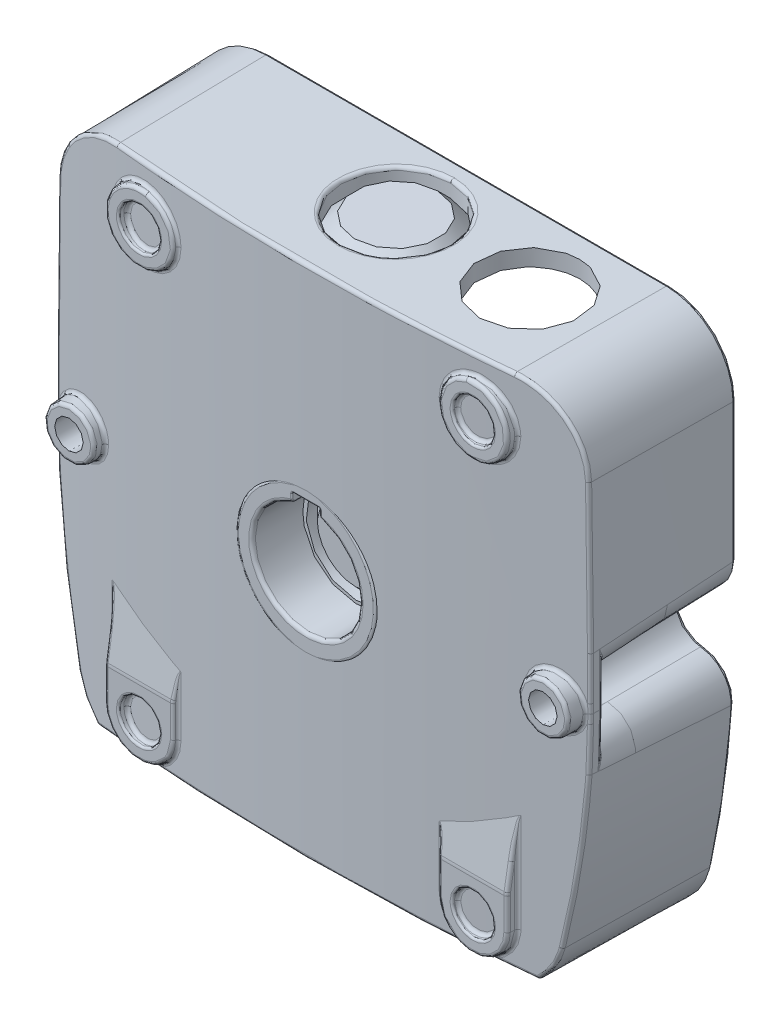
SolidWorks part; units mm, degrees
ref_plane "Piano frontale" through (0, 0, 0) normal (0, 0, 1) x (1, 0, 0)
ref_plane "Piano superiore" through (0, 0, 0) normal (0, 1, 0) x (1, 0, 0)
ref_plane "Piano destro" through (0, 0, 0) normal (1, 0, 0) x (0, 0, -1)
imported_body "Importato1"
ref_plane "Piano1" through (0.0013, 31.8346, -0.2263) normal (0, -1, 0.0071) x (1, 0, 0)
sketch "Schizzo1" plane through (0.0013, 31.8346, -0.2263) normal (0, -1, 0.0071) x (1, 0, 0)
  line L0 (27.516, 22.9624) -> (22.3608, 23.3922) construction
  line L1 (24.9384, 23.1773) -> (25.2688, 27.1398) construction
  line L2 (21.8987, 23.8647) -> (21.5566, 23.8647)
  line L3 (22.3608, 23.3922) -> (22.3608, 22.8816)
  line L4 (22.3608, 22.8816) -> (21.5566, 22.8816)
  line L5 (21.5566, 22.8816) -> (21.5566, 23.8647)
  spline S0 degree 3 poles (-2560.6714, 1546.6307) (98.4318, 82.7731) (-46.614, -43.6008) (82.9585, 98.5936) (1487.3227, -2592.3348) knots -22.541542 -22.541542 -22.541542 -22.541542 0.500006 23.541505 23.541505 23.541505 23.541505 only from (22.3608, 23.3922) to (21.8987, 23.8647) construction
  spline S1 degree 3 poles (22.3608, 23.3922) (22.2408, 23.4012) (22.0083, 23.5096) (21.905, 23.7445) (21.8987, 23.8647) knots 0.000003 0.000003 0.000003 0.000003 0.500006 1.000006 1.000006 1.000006 1.000006
revolve "Rivoluzione3" add sketch "Schizzo1" angle 180 about L1
